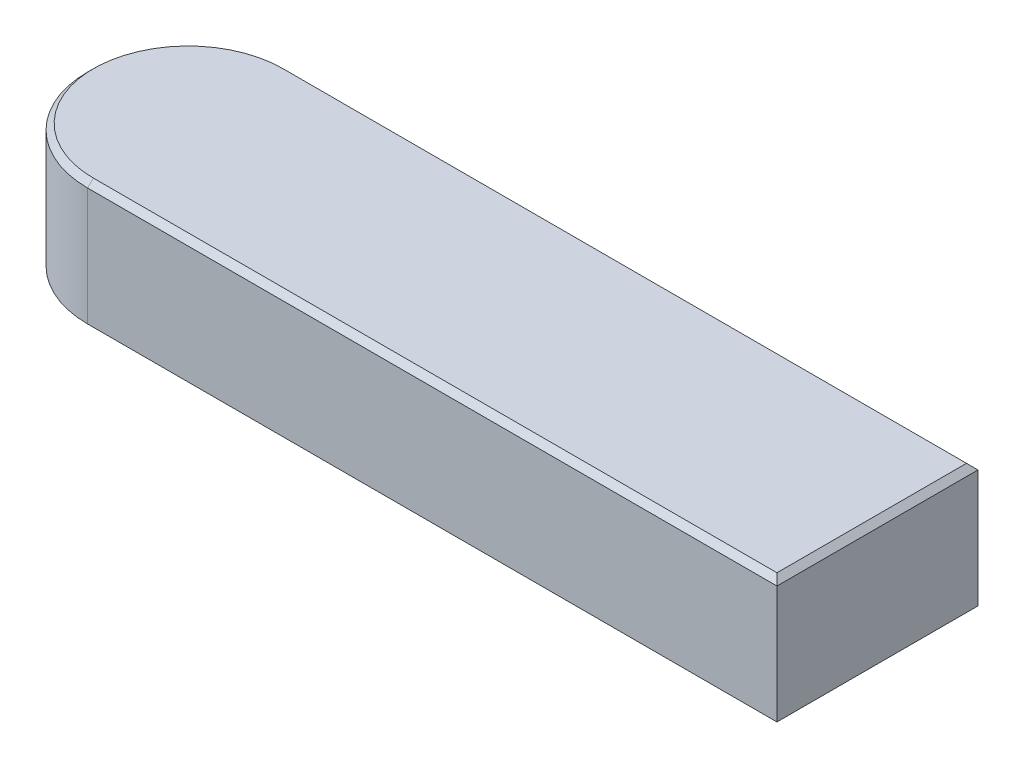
SolidWorks part; units mm, degrees
ref_plane "Plan1" through (0, 0, 0) normal (0, 0, 1) x (1, 0, 0)
ref_plane "Plan2" through (0, 0, 0) normal (0, 1, 0) x (1, 0, 0)
ref_plane "Plan3" through (0, 0, 0) normal (1, 0, 0) x (0, 0, -1)
sketch "Esquisse1" plane through (0, 0, 0) normal (0, 1, 0) x (1, 0, 0)
  line L0 (0, 0) -> (14, 0) construction
  line L1 (48, 7) -> (0, 7)
  line L2 (48, -7) -> (0, -7)
  line L3 (-7, -7) -> (-7, 7) construction
  line L4 (48, -7) -> (48, 7)
  arc A0 (0, 7) -> (0, -7) centre (0, 0) ccw
  dimension "a" = 14
  dimension "l" = 55
extrude "Base-Extrusion" add sketch "Esquisse1" along normal blind 9
chamfer "Chanfrein1" distance 0.4 angle 45 8 edges at (48, 9, 0) (24, 9, -7) (-7, 9, 0) (24, 0, -7) (48, 0, 0) (24, 0, 7) (-7, 0, 0) (24, 9, 7)
ref_plane "Plan-tangent-arbre" through (0, 5.5, 0) normal (0, 1, 0) x (-1, 0, 0)
sketch "Section-rainure-alesage" plane through (0, 0, 0) normal (1, 0, 0) x (0, 0, -1)
  line L0 (7, 5.5) -> (7, 9.3) construction
  line L1 (50, 5.5) -> (-50, 5.5) construction
  line L2 (7, 9.3) -> (-7, 9.3) construction
  line L3 (-7, 9.3) -> (-7, 5.5) construction
  line L4 (-7, 5.5) -> (7, 5.5) construction
  line L5 (7, 8.6) -> (7, 0.4) construction
  line L6 (-7, 8.6) -> (-7, 0.4) construction
  dimension "k-d" = 3.8
